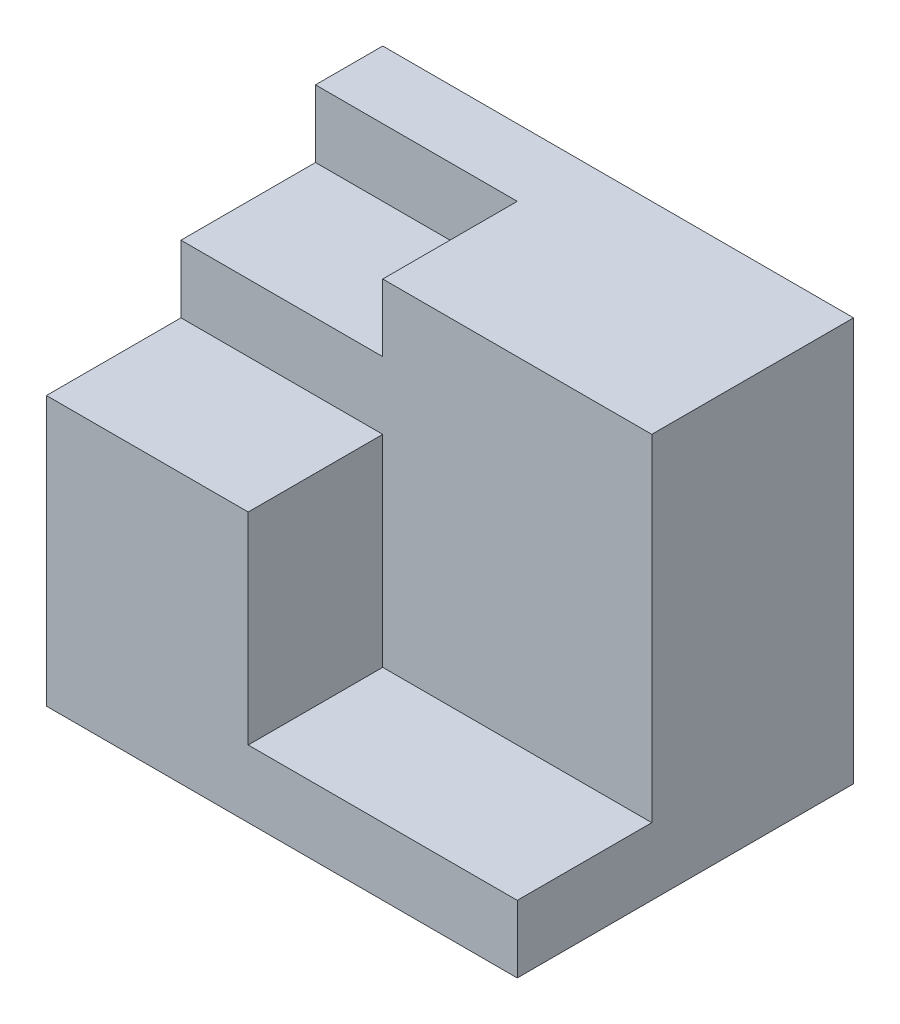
SolidWorks part; units mm, degrees
ref_plane "Alzado" through (0, 0, 0) normal (0, 0, 1) x (1, 0, 0)
ref_plane "Planta" through (0, 0, 0) normal (0, 1, 0) x (1, 0, 0)
ref_plane "Vista lateral" through (0, 0, 0) normal (1, 0, 0) x (0, 0, -1)
sketch "Croquis1" plane through (0, 0, 0) normal (0, 0, 1) x (1, 0, 0)
  line L0 (35, 30) -> (-35, -30) construction
  line L1 (-35, 30) -> (35, 30)
  line L2 (-35, 30) -> (-35, -30)
  line L3 (-35, -30) -> (35, -30)
  line L4 (35, 30) -> (35, -30)
  line L5 (35, -30) -> (-35, 30) construction
  dimension "D1" = 60
  dimension "D2" = 70
extrude "Saliente-Extruir1" add sketch "Croquis1" along normal mid plane 50
sketch "Croquis5" plane through (0, 0, 25) normal (0, 0, 1) x (1, 0, 0)
  line L0 (-35, 10) -> (-5, 10)
  line L1 (-35, 30) -> (-35, -30) construction
  line L2 (-5, 10) -> (-5, -20)
  line L3 (-5, -20) -> (35, -20)
  line L4 (35, -30) -> (35, 30) construction
  line L5 (35, -20) -> (35, 30)
  line L6 (35, 30) -> (-35, 30)
  line L7 (-35, 30) -> (-35, 10)
  dimension "D1" = 30
  dimension "D2" = 50
  dimension "D3" = 30
extrude "Cortar-Extruir4" cut sketch "Croquis5" against normal blind 20
sketch "Croquis6" plane through (0, 0, 5) normal (0, 0, 1) x (1, 0, 0)
  line L1 (-35, 30) -> (-5, 30)
  line L2 (-35, 30) -> (-35, 20)
  line L3 (-35, 20) -> (-5, 20)
  line L4 (-5, 30) -> (-5, 20)
  dimension "D1" = 10
  dimension "D2" = 30
extrude "Cortar-Extruir5" cut sketch "Croquis6" against normal blind 20
